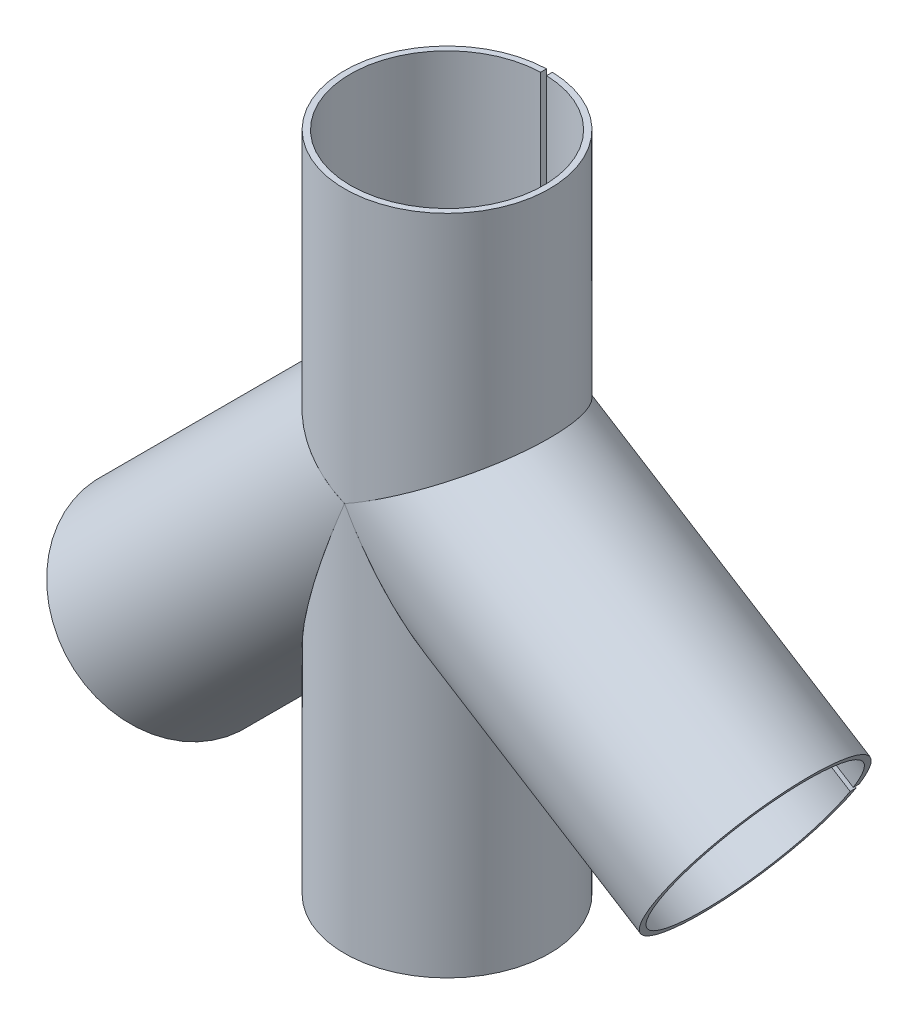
SolidWorks part; units mm, degrees
ref_plane "前视基准面" through (0, 0, 0) normal (0, 0, 1) x (1, 0, 0)
ref_plane "上视基准面" through (0, 0, 0) normal (0, 1, 0) x (1, 0, 0)
ref_plane "右视基准面" through (0, 0, 0) normal (1, 0, 0) x (0, 0, -1)
sketch "草图1" plane through (0, 0, 0) normal (0, 0, 1) x (1, 0, 0)
  line L0 (0, 46.1704) -> (0, 0) construction
  line L1 (0, 0) -> (52.1963, -32.6972) construction
  line L2 (0, -66) -> (0, 0) construction
  line L3 (0, 0) -> (-46.5623, -46.5623) construction
  line L4 (-17.3631, 46.1704) -> (17.3631, 46.1704) construction
  line L5 (-58.8399, -34.2848) -> (-34.2848, -58.8399) construction
  line L6 (-17.3631, -66) -> (17.3631, -66) construction
  line L7 (42.9787, -47.4116) -> (61.4138, -17.9828) construction
  line L8 (0, -66) -> (0, -67) construction
  line L9 (-17.3631, 46.1704) -> (-17.3631, 7.192) construction
  line L10 (-17.3631, 7.192) -> (-58.8399, -34.2848) construction
  line L11 (-34.2848, -58.8399) -> (-17.3631, -41.9182) construction
  line L12 (-17.3631, -41.9182) -> (-17.3631, -66) construction
  line L13 (17.3631, -66) -> (17.3631, -31.3652) construction
  line L14 (17.3631, -31.3652) -> (42.9787, -47.4116) construction
  line L15 (17.3631, 46.1704) -> (17.3631, 9.6118) construction
  line L16 (17.3631, 9.6118) -> (61.4138, -17.9828) construction
  line L17 (0, 0) -> (0, 46.1704)
  line L18 (-17.3631, 7.192) -> (0, 0) construction
  line L19 (0, 0) -> (17.3631, 9.6118) construction
  line L20 (-17.3631, -41.9182) -> (0, 0) construction
  line L21 (0, 0) -> (17.3631, -31.3652) construction
  line L22 (0, 0) -> (52.1963, -32.6972)
  dimension "R" = 17.3631
  dimension "l1" = 46.1704
  dimension "L2" = 65.8491
  dimension "L3" = 66
  dimension "L4" = 61.5918
  dimension "B1" = 45
  dimension "B2" = 57.936
  dimension "t" = 1
sketch "草图2" plane through (0, 0, 0) normal (0, 1, 0) x (1, 0, 0)
  circle A0 centre (0, 0) radius 17.3631
extrude "拉伸-薄壁1" add sketch "草图2" along normal up to vertex (46.1704 mm away) thin
ref_plane "基准面1" through (52.1963, -32.6972, 0) normal (0.8475, -0.5309, 0) x (0, 0, -1)
ref_plane "基准面2" through (-46.5623, -46.5623, 0) normal (-0.7071, -0.7071, 0) x (0.7071, -0.7071, 0)
sketch "草图3" plane through (52.1963, -32.6972, 0) normal (0.8475, -0.5309, 0) x (0, 0, -1)
  circle A0 centre (0, 0) radius 17.3631
extrude "拉伸-薄壁2" add sketch "草图3" against normal up to vertex (61.5918 mm away) separate body thin
sketch "草图4" plane through (-46.5623, -46.5623, 0) normal (-0.7071, -0.7071, 0) x (0.7071, -0.7071, 0)
  circle A0 centre (0, 0) radius 17.3631
extrude "拉伸-薄壁3" add sketch "草图4" against normal up to vertex (65.8491 mm away) separate body thin
sketch "草图5" plane through (0, 0, 0) normal (0, 1, 0) x (1, 0, 0)
  circle A0 centre (0, 0) radius 17.3631
extrude "拉伸-薄壁4" add sketch "草图5" against normal up to vertex (66 mm away) separate body thin
sketch "草图6" plane through (0, 0, 0) normal (0, 0, 1) x (1, 0, 0)
  line L0 (-17.3631, 7.192) -> (0, 0) construction
  line L1 (0, 0) -> (17.3631, 9.6118) construction
  line L2 (17.3631, 46.1704) -> (17.3631, 9.6118) construction
  line L3 (-17.3631, 46.1704) -> (-17.3631, 7.192) construction
  line L4 (-17.3631, 46.1704) -> (17.3631, 46.1704) construction
  line L5 (-17.3631, 7.192) -> (0, 0)
  line L6 (0, 0) -> (17.3631, 9.6118)
  line L7 (17.3631, 46.1704) -> (17.3631, 9.6118)
  line L8 (-17.3631, 46.1704) -> (-17.3631, 7.192)
  line L9 (-17.3631, 46.1704) -> (17.3631, 46.1704)
extrude "切除-拉伸1" cut sketch "草图6" against normal through all and the other way through all flip side to cut
sketch "草图7" plane through (0, 0, 0) normal (0, 0, 1) x (1, 0, 0)
  line L0 (-17.3631, 7.192) -> (0, 0) construction
  line L1 (-17.3631, -41.9182) -> (0, 0) construction
  line L2 (-58.8399, -34.2848) -> (-34.2848, -58.8399) construction
  line L3 (-17.3631, 7.192) -> (-58.8399, -34.2848) construction
  line L4 (-17.3631, 7.192) -> (0, 0)
  line L5 (-17.3631, -41.9182) -> (0, 0)
  line L6 (-58.8399, -34.2848) -> (-34.2848, -58.8399)
  line L7 (-17.3631, 7.192) -> (-58.8399, -34.2848)
  line L8 (-34.2848, -58.8399) -> (-17.3631, -41.9182) construction
  line L9 (-34.2848, -58.8399) -> (-17.3631, -41.9182)
extrude "切除-拉伸2" cut sketch "草图7" against normal through all and the other way through all flip side to cut
sketch "草图10" plane through (0, 0, 0) normal (0, 0, 1) x (1, 0, 0)
  line L0 (-17.3631, -41.9182) -> (-17.3631, -66) construction
  line L1 (-17.3631, -41.9182) -> (0, 0) construction
  line L2 (0, 0) -> (17.3631, -31.3652) construction
  line L3 (-17.3631, -66) -> (17.3631, -66) construction
  line L4 (17.3631, -66) -> (17.3631, -31.3652) construction
  line L5 (-17.3631, -41.9182) -> (-17.3631, -66)
  line L6 (-17.3631, -41.9182) -> (0, 0)
  line L7 (0, 0) -> (17.3631, -31.3652)
  line L8 (-17.3631, -66) -> (17.3631, -66)
  line L9 (17.3631, -66) -> (17.3631, -31.3652)
extrude "切除-拉伸5" cut sketch "草图10" against normal through all and the other way through all flip side to cut
sketch "草图11" plane through (0, 0, 0) normal (0, 0, 1) x (1, 0, 0)
  line L0 (0, 0) -> (17.3631, -31.3652) construction
  line L1 (17.3631, -31.3652) -> (42.9787, -47.4116) construction
  line L2 (42.9787, -47.4116) -> (61.4138, -17.9828) construction
  line L3 (17.3631, 9.6118) -> (61.4138, -17.9828) construction
  line L4 (0, 0) -> (17.3631, 9.6118) construction
  line L5 (0, 0) -> (17.3631, -31.3652)
  line L6 (17.3631, -31.3652) -> (42.9787, -47.4116)
  line L7 (42.9787, -47.4116) -> (61.4138, -17.9828)
  line L8 (17.3631, 9.6118) -> (61.4138, -17.9828)
  line L9 (0, 0) -> (17.3631, 9.6118)
extrude "切除-拉伸6" cut sketch "草图11" against normal through all and the other way through all flip side to cut
extrude "切除-拉伸-薄壁6" cut sketch "草图1" against normal through all thin
sketch "草图12" plane through (0, 0, 0) normal (0, 0, 1) x (1, 0, 0)
  line L0 (0, -66) -> (0, 0) construction
  line L1 (0, 0) -> (-46.5623, -46.5623) construction
  line L2 (0, -66) -> (0, 0)
  line L3 (0, 0) -> (-46.5623, -46.5623)
extrude "切除-拉伸-薄壁7" cut sketch "草图12" against normal through all thin
equation "\"D5@拉伸-薄壁1\" = \"t@草图1\""
equation "\"D5@拉伸-薄壁2\" = \"t@草图1\""
equation "\"D5@拉伸-薄壁3\" = \"t@草图1\""
equation "\"D5@拉伸-薄壁4\" = \"t@草图1\""
